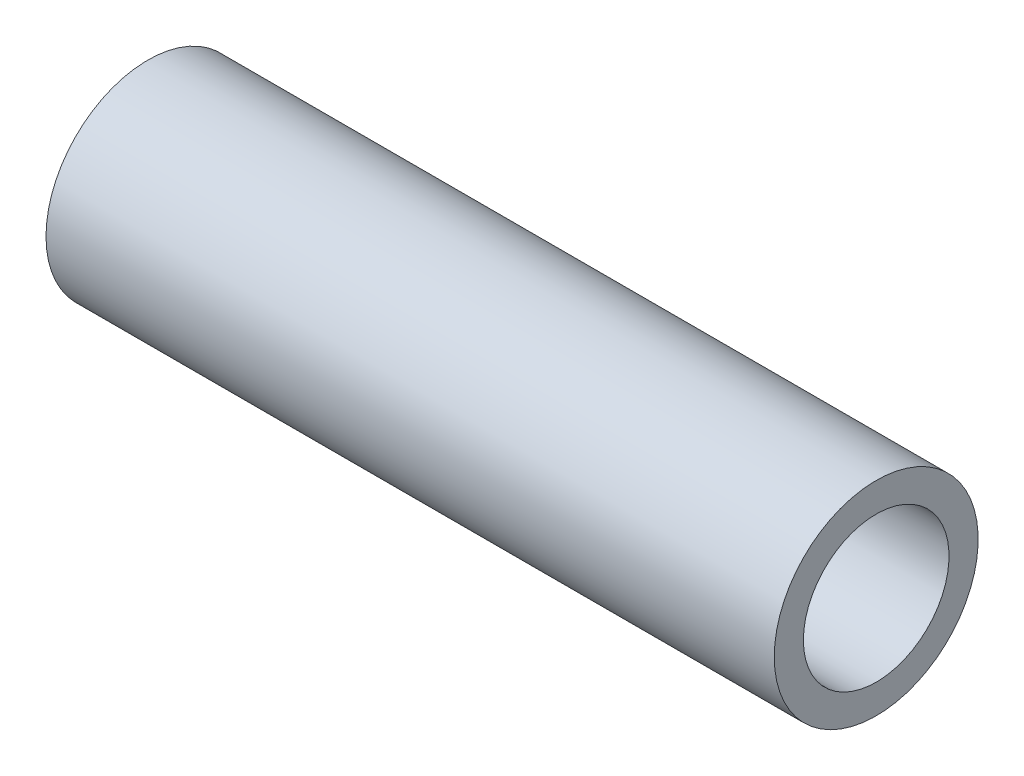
SolidWorks part; units mm, degrees
ref_plane "Front" through (0, 0, 0) normal (0, 0, 1) x (1, 0, 0)
ref_plane "Top" through (0, 0, 0) normal (0, 1, 0) x (1, 0, 0)
ref_plane "Right" through (0, 0, 0) normal (1, 0, 0) x (0, 0, -1)
sketch "Sketch1" plane through (0, 0, 0) normal (0, 0, 1) x (1, 0, 0)
  line L0 (0, 0) -> (76.2, 0)
  line L1 (9.9848, 0) -> (-9.9848, 0) construction
  dimension "D1" = 76.2
other "Structural Member1"
ref_plane "Plane1" through (0, 0, 0) normal (1, 0, 0) x (0, 0, -1)
sketch "Sketch11" plane through (0, 0, 0) normal (1, 0, 0) x (0, 0, -1)
  circle A0 centre (0, 0) radius 7.62
  circle A1 centre (0, 0) radius 10.668
  point P3 (0, 0)
  dimension "D1" = 21.336
  dimension "D2" = 15.24
